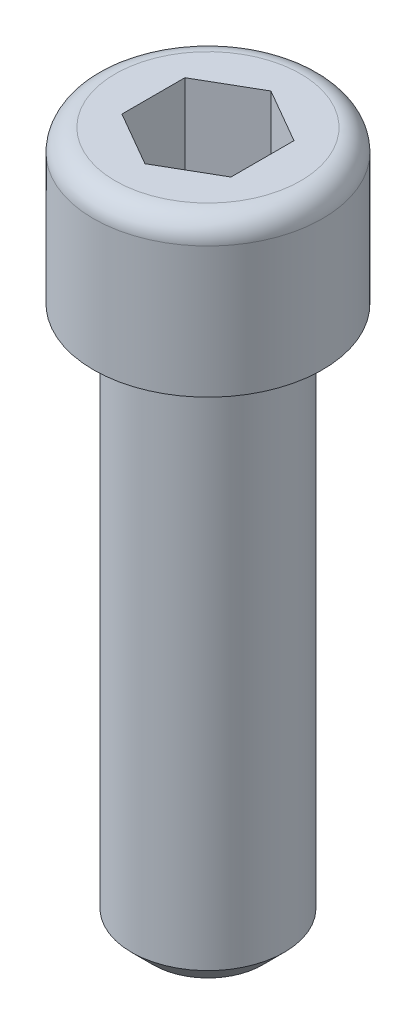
SolidWorks part; units mm, degrees
ref_plane "Plan de face" through (0, 0, 0) normal (0, 0, 1) x (1, 0, 0)
ref_plane "Plan de dessus" through (0, 0, 0) normal (0, 1, 0) x (1, 0, 0)
ref_plane "Plan de droite" through (0, 0, 0) normal (1, 0, 0) x (0, 0, -1)
sketch "Esquisse1" plane through (0, 0, 0) normal (0, 1, 0) x (1, 0, 0)
  circle A0 centre (0, 0) radius 7
extrude "Extrusion1" add sketch "Esquisse1" against normal blind 50
sketch "Esquisse2" plane through (0, 0, 0) normal (0, 1, 0) x (-1, 0, 0)
  circle A0 centre (0, 0) radius 10.5
extrude "Extrusion2" add sketch "Esquisse2" along normal blind 14
fillet "Congé1" radius 2 1 edges at (0, 14, 10.5)
sketch "Esquisse3" plane through (0, 14, 0) normal (0, 1, 0) x (-1, 0, 0)
  line L1 (0, 5.7735) -> (-5, 2.8868)
  line L2 (-5, 2.8868) -> (-5, -2.8868)
  line L3 (-5, -2.8868) -> (0, -5.7735)
  line L4 (0, -5.7735) -> (5, -2.8868)
  line L5 (5, -2.8868) -> (5, 2.8868)
  line L6 (5, 2.8868) -> (0, 5.7735)
  circle A0 centre (0, 0) radius 5 construction
  dimension "D1" = 10
extrude "Enlèv. mat.-Extru.1" cut sketch "Esquisse3" against normal blind 11
chamfer "Chanfrein1" distance 2 angle 45 1 edges at (0, -50, 7)
